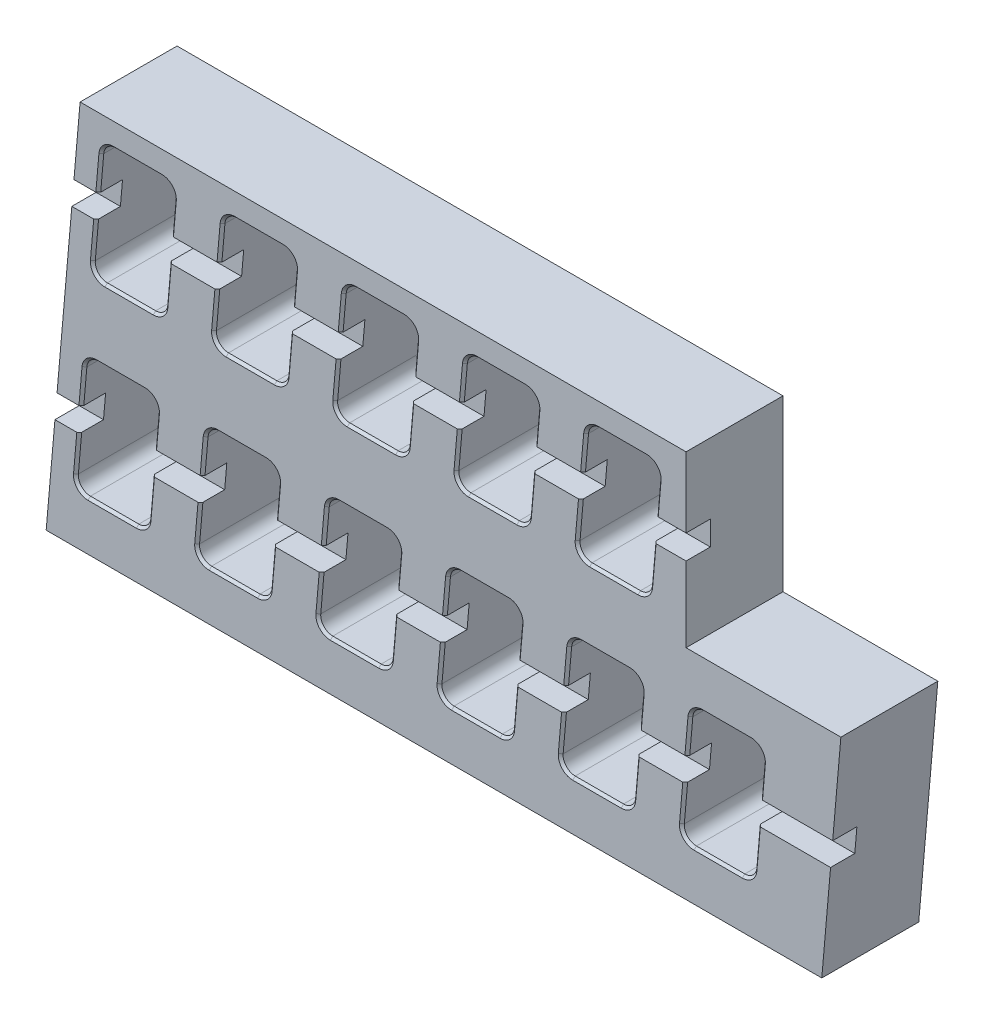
SolidWorks part; units mm, degrees
ref_plane "Front" through (0, 0, 0) normal (0, 0, 1) x (1, 0, 0)
ref_plane "Top" through (0, 0, 0) normal (0, 1, 0) x (1, 0, 0)
ref_plane "Right" through (0, 0, 0) normal (1, 0, 0) x (0, 0, -1)
sketch "Sketch1" plane through (0, 0, 0) normal (0, 0, 1) x (1, 0, 0)
  line L0 (0, 0) -> (160, 0)
  line L1 (0, 0) -> (6.9991, 80)
  line L2 (6.9991, 80) -> (166.9991, 80)
  line L6 (160, 0) -> (166.9991, 80)
  dimension "D1" = 85
  dimension "D2" = 160
  dimension "D3" = 80
extrude "Extrude1" add sketch "Sketch1" along normal blind 20
sketch "Sketch2" plane through (0, 0, 20) normal (0, 0, 1) x (1, 0, 0)
  line L0 (11.3811, 72.7179) -> (9.6313, 52.7179)
  line L1 (13.8716, 75) -> (23.8525, 75)
  line L2 (6.9991, 80) -> (0, 0) construction
  line L3 (166.9991, 80) -> (6.9991, 80) construction
  line L4 (26.343, 72.2821) -> (24.5932, 52.2821)
  line L5 (12.1218, 50) -> (22.1027, 50)
  arc A0 (11.3811, 72.7179) -> (13.8716, 75) centre (13.8716, 72.5) cw
  arc A1 (9.6313, 52.7179) -> (12.1218, 50) centre (12.1218, 52.5) ccw
  arc A2 (22.1027, 50) -> (24.5932, 52.2821) centre (22.1027, 52.5) ccw
  arc A3 (26.343, 72.2821) -> (23.8525, 75) centre (23.8525, 72.5) ccw
  point P9 (11.5807, 75)
  point P17 (26.5807, 75)
  dimension "D5" = 2.5
  dimension "D1" = 5
  dimension "D2" = 5
  dimension "D3" = 15
  dimension "D4" = 25
extrude "Cut-Extrude1" cut sketch "Sketch2" against normal blind 20
chamfer "Chamfer1" distance 0.5 angle 45 8 edges at (12.1826, 74.3432, 20) (10.5062, 62.7179, 20) (10.2786, 50.811, 20) (17.1123, 50, 20) (23.7917, 50.6568, 20) (25.4681, 62.2821, 20) (25.6957, 74.189, 20) (18.862, 75, 20)
pattern_linear "LPattern2" count 6 spacing 25 along (1, 0, 0) count 2 spacing 40 along (-0.0872, -0.9962, 0) of "Cut-Extrude1", "Chamfer1"
sketch "Sketch3" plane through (0, 0, 20) normal (0, 0, 1) x (1, 0, 0)
  line L1 (3.2854, 60.5) -> (167.3007, 60.5)
  line L3 (3.7229, 65.5) -> (167.7381, 65.5)
  line L5 (-0.2008, 20.6522) -> (163.8145, 20.6522)
  line L7 (0.2366, 25.6522) -> (164.2519, 25.6522)
  line L10 (5.0067, 80.1743) -> (-1.9924, 0.1743)
  line L11 (3.7229, 65.5) -> (3.2854, 60.5)
  line L12 (13.8716, 75.5) -> (23.8525, 75.5) construction
  line L13 (10.3853, 35.6522) -> (20.3662, 35.6522) construction
  line L14 (167.3007, 60.5) -> (167.7381, 65.5)
  line L15 (161.9924, -0.1743) -> (168.9915, 79.8257)
  line L16 (163.8145, 20.6522) -> (164.2519, 25.6522)
  line L17 (0.2366, 25.6522) -> (-0.2008, 20.6522)
  dimension "D1" = 10
  dimension "D2" = 5
  dimension "D3" = 10
  dimension "D4" = 5
  dimension "D5" = 2
  dimension "D6" = 2
extrude "Cut-Extrude2" cut sketch "Sketch3" against normal blind 5
sketch "Sketch7" plane through (0, 0, 20) normal (0, 0, 1) x (1, 0, 0)
  line L0 (166.9991, 80) -> (6.9991, 80) construction
  line L1 (131.9991, 88.4657) -> (172.9873, 88.4657)
  line L2 (131.9991, 88.4657) -> (131.9991, 45)
  line L3 (131.9991, 45) -> (172.9873, 45)
  line L4 (172.9873, 88.4657) -> (172.9873, 45)
  dimension "D1" = 125
  dimension "D2" = 35
extrude "Cut-Extrude6" cut sketch "Sketch7" against normal through all
sketch "Sketch Pattern" plane through (0, 0, 20) normal (0, 0, 1) x (1, 0, 0)
  point P0 (135.3853, 35.1522)
  point P1 (110.3853, 35.1522)
  point P3 (85.3853, 35.1522)
  point P5 (60.3853, 35.1522)
  point P7 (35.3853, 35.1522)
  point P9 (10.3853, 35.1522)
  point P11 (13.8716, 75)
  point P13 (38.8164, 74.8613)
  point P15 (63.8716, 75)
  point P16 (88.8716, 75)
  point P18 (113.8716, 75)
